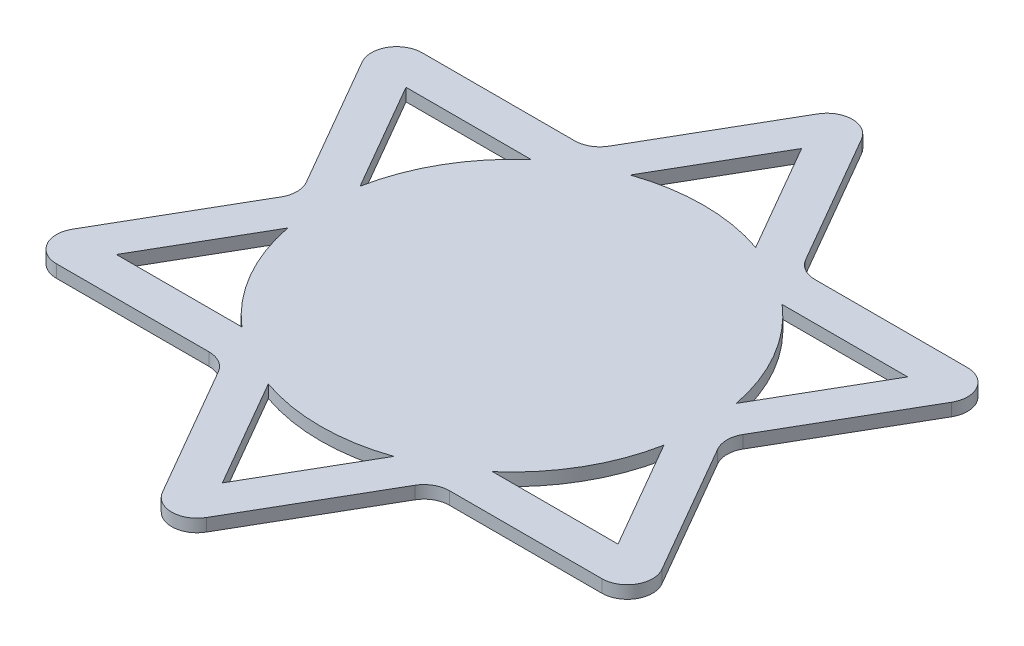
SolidWorks part; units mm, degrees
ref_plane "Front Plane" through (0, 0, 0) normal (0, 0, 1) x (1, 0, 0)
ref_plane "Top Plane" through (0, 0, 0) normal (0, 1, 0) x (1, 0, 0)
ref_plane "Right Plane" through (0, 0, 0) normal (1, 0, 0) x (0, 0, -1)
sketch "Sketch1" plane through (0, 0, 0) normal (0, 1, 0) x (1, 0, 0)
  line L0 (64.6335, -43.654) -> (70.6575, -54.0877)
  line L1 (48.0512, -72.3754) -> (43.0976, -80.9552)
  line L2 (43.0976, -80.9552) -> (53.0047, -80.9552)
  line L3 (57.9479, -83.8092) -> (62.9015, -92.389)
  line L4 (67.855, -83.8092) -> (62.9015, -92.389)
  line L5 (72.7982, -80.9552) -> (82.7053, -80.9552)
  line L6 (77.7518, -72.3754) -> (82.7053, -80.9552)
  line L7 (82.7053, -58.0877) -> (77.7518, -66.6675)
  line L8 (72.7982, -58.0877) -> (82.7053, -58.0877)
  line L9 (62.9015, -46.654) -> (67.855, -55.2338)
  line L10 (62.9015, -46.654) -> (57.9479, -55.2338)
  line L11 (62.9015, -40.654) -> (37.9015, -55.0877) construction
  line L12 (37.9015, -55.0877) -> (37.9015, -83.9552) construction
  line L13 (37.9015, -83.9552) -> (62.9015, -98.389) construction
  line L14 (62.9015, -98.389) -> (87.9015, -83.9552) construction
  line L15 (87.9015, -83.9552) -> (87.9015, -55.0877) construction
  line L16 (87.9015, -55.0877) -> (62.9015, -40.654) construction
  line L17 (43.0976, -58.0877) -> (53.0047, -58.0877)
  line L18 (41.3656, -55.0877) -> (53.4135, -55.0877)
  line L19 (86.1694, -58.0877) -> (80.1455, -68.5215)
  line L20 (43.0976, -58.0877) -> (48.0512, -66.6675)
  line L21 (61.1694, -43.654) -> (55.1455, -54.0877)
  line L22 (41.3656, -83.9552) -> (53.4135, -83.9552)
  line L23 (39.6335, -58.0877) -> (45.6575, -68.5215)
  line L24 (45.6575, -70.5215) -> (39.6335, -80.9552)
  line L25 (43.0976, -80.9552) -> (53.4135, -80.9552) construction
  line L26 (80.1455, -70.5215) -> (86.1694, -80.9552)
  line L27 (70.6575, -84.9552) -> (64.6335, -95.389)
  line L28 (48.2555, -72.0215) -> (43.0976, -80.9552) construction
  line L29 (55.1455, -84.9552) -> (61.1694, -95.389)
  line L30 (72.3895, -55.0877) -> (84.4374, -55.0877)
  line L31 (72.3895, -83.9552) -> (84.4374, -83.9552)
  line L32 (43.0976, -58.0877) -> (48.2555, -67.0215) construction
  line L33 (43.0976, -58.0877) -> (53.4135, -58.0877) construction
  line L34 (62.9015, -46.654) -> (57.7436, -55.5877) construction
  line L35 (62.9015, -46.654) -> (68.0594, -55.5877) construction
  line L36 (72.3895, -58.0877) -> (82.7053, -58.0877) construction
  line L37 (82.7053, -58.0877) -> (77.5474, -67.0215) construction
  line L38 (77.5474, -72.0215) -> (82.7053, -80.9552) construction
  line L39 (72.3895, -80.9552) -> (82.7053, -80.9552) construction
  line L40 (68.0594, -83.4552) -> (62.9015, -92.389) construction
  line L41 (57.7436, -83.4552) -> (62.9015, -92.389) construction
  arc A0 (55.1455, -54.0877) -> (53.4135, -55.0877) centre (53.4135, -53.0877) cw
  arc A1 (39.6335, -58.0877) -> (41.3656, -55.0877) centre (41.3656, -57.0877) cw
  circle A2 centre (62.9015, -69.5215) radius 25 construction
  arc A3 (41.3656, -83.9552) -> (39.6335, -80.9552) centre (41.3656, -81.9552) cw
  arc A4 (64.6335, -95.389) -> (61.1694, -95.389) centre (62.9015, -94.389) cw
  arc A5 (86.1694, -80.9552) -> (84.4374, -83.9552) centre (84.4374, -81.9552) cw
  arc A6 (84.4374, -55.0877) -> (86.1694, -58.0877) centre (84.4374, -57.0877) cw
  arc A7 (61.1694, -43.654) -> (64.6335, -43.654) centre (62.9015, -44.654) cw
  arc A8 (72.3895, -55.0877) -> (70.6575, -54.0877) centre (72.3895, -53.0877) cw
  arc A9 (80.1455, -70.5215) -> (80.1455, -68.5215) centre (81.8776, -69.5215) cw
  arc A10 (72.3895, -83.9552) -> (70.6575, -84.9552) centre (72.3895, -85.9552) ccw
  arc A11 (53.4135, -83.9552) -> (55.1455, -84.9552) centre (53.4135, -85.9552) cw
  arc A12 (45.6575, -70.5215) -> (45.6575, -68.5215) centre (43.9254, -69.5215) ccw
  arc A13 (43.0976, -80.9552) -> (43.0976, -80.9552) centre (43.0976, -80.9552) cw
  arc A14 (72.7982, -80.9552) -> (77.7518, -72.3754) centre (62.9015, -69.5215) ccw
  arc A15 (62.9015, -92.389) -> (62.9015, -92.389) centre (62.9015, -92.389) cw
  arc A17 (82.7053, -80.9552) -> (82.7053, -80.9552) centre (82.7053, -80.9552) cw
  arc A18 (67.855, -55.2338) -> (57.9479, -55.2338) centre (62.9015, -69.5215) ccw
  arc A19 (82.7053, -58.0877) -> (82.7053, -58.0877) centre (82.7053, -58.0877) cw
  arc A20 (53.0047, -58.0877) -> (48.0512, -66.6675) centre (62.9015, -69.5215) ccw
  arc A21 (62.9015, -46.654) -> (62.9015, -46.654) centre (62.9015, -46.654) cw
  arc A22 (48.0512, -72.3754) -> (53.0047, -80.9552) centre (62.9015, -69.5215) ccw
  arc A23 (43.0976, -58.0877) -> (43.0976, -58.0877) centre (43.0976, -58.0877) cw
  arc A24 (57.9479, -83.8092) -> (67.855, -83.8092) centre (62.9015, -69.5215) ccw
  arc A25 (77.7518, -66.6675) -> (72.7982, -58.0877) centre (62.9015, -69.5215) ccw
  arc A26 (77.5474, -72.0215) -> (77.5474, -67.0215) centre (81.8776, -69.5215) cw construction
  arc A27 (72.3895, -58.0877) -> (68.0594, -55.5877) centre (72.3895, -53.0877) cw construction
  arc A28 (57.7436, -55.5877) -> (53.4135, -58.0877) centre (53.4135, -53.0877) cw construction
  arc A29 (48.2555, -72.0215) -> (48.2555, -67.0215) centre (43.9254, -69.5215) ccw construction
  arc A30 (53.4135, -80.9552) -> (57.7436, -83.4552) centre (53.4135, -85.9552) cw construction
  arc A31 (72.3895, -80.9552) -> (68.0594, -83.4552) centre (72.3895, -85.9552) ccw construction
  point P37 (71.2348, -55.0877)
  point P42 (71.2348, -83.9552)
  dimension "D1" = 50
  dimension "D4" = 3
  dimension "D2" = 2
  dimension "D3" = 2
extrude "Extrude1" add sketch "Sketch1" along normal blind 1
